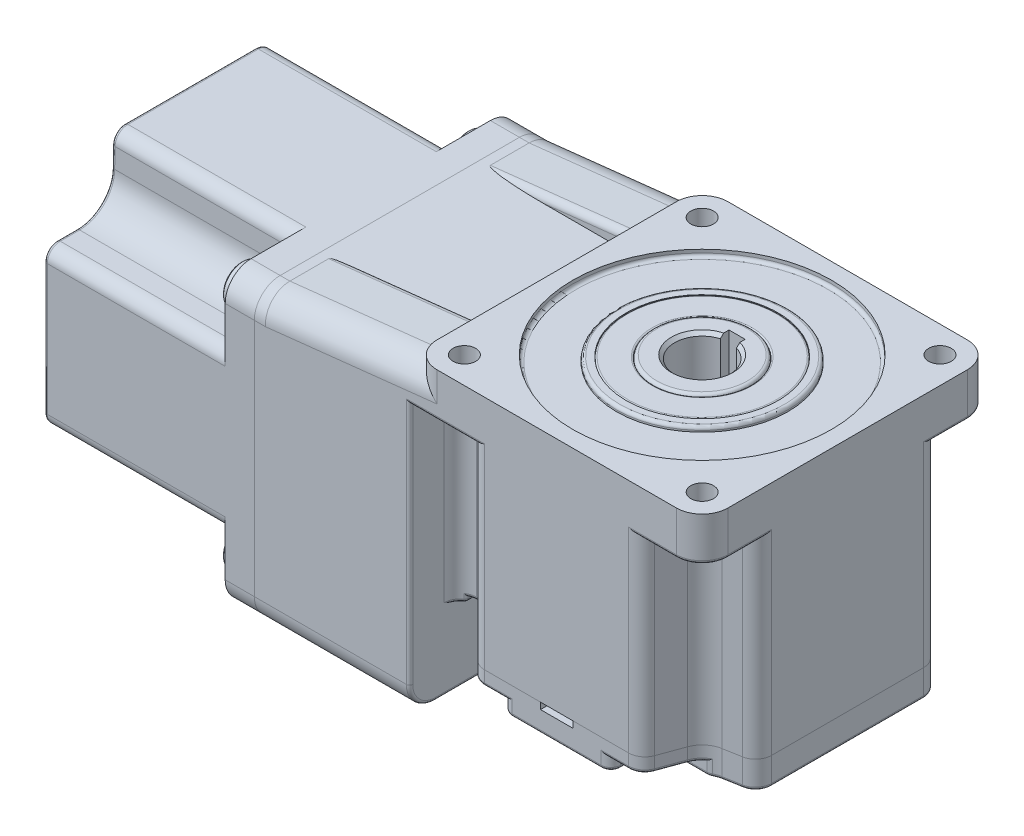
SolidWorks part; units mm, degrees
ref_plane "前视基准面" through (0, 0, 0) normal (0, 0, 1) x (1, 0, 0)
ref_plane "上视基准面" through (0, 0, 0) normal (0, 1, 0) x (1, 0, 0)
ref_plane "右视基准面" through (0, 0, 0) normal (1, 0, 0) x (0, 0, -1)
imported_body "90中空箱体-1-surface1"
imported_body "30X47X7-1-surface1"
imported_body "出轴后盖-1-surface1"
imported_body "30X47X7-2-surface1"
imported_body "空心输出轴-1-surface1"
sketch "草图1" plane through (-75.3062, 0, 0) normal (-1, 0, 0) x (0, 0, 1)
  line L0 (37, 32.9085) -> (-37, 32.9085) construction
  line L2 (-37, -57.0915) -> (37, -57.0915)
  line L3 (-45, -49.0915) -> (-45, 24.9085)
  line L4 (-37, 32.9085) -> (37, 32.9085)
  line L5 (45, -49.0915) -> (45, 24.9085)
  line L6 (-45, -57.0915) -> (45, 32.9085) construction
  line L7 (-45, 32.9085) -> (45, -57.0915) construction
  arc A0 (37, -57.0915) -> (45, -49.0915) centre (37, -49.0915) ccw
  arc A1 (-37, -57.0915) -> (-45, -49.0915) centre (-37, -49.0915) cw
  arc A2 (37, 32.9085) -> (45, 24.9085) centre (37, 24.9085) cw
  arc A3 (-45, 24.9085) -> (-37, 32.9085) centre (-37, 24.9085) cw
  dimension "D1" = 8
extrude "凸台-拉伸1" add sketch "草图1" along normal blind 65
sketch "草图2" plane through (-140.3062, 0, 0) normal (-1, 0, 0) x (0, 0, 1)
  line L0 (-35, 12.0801) -> (-41, 12.0801)
  line L1 (-45, 8.0801) -> (-45, 24.9085)
  line L2 (-35, -36.2631) -> (-35, -36.0631)
  line L3 (-24.1716, -47.0915) -> (-24.1716, -53.0915)
  line L6 (-37, 32.9085) -> (-20.2852, 32.9085)
  line L7 (-45, 24.9085) -> (-45, -49.0915) construction
  line L8 (-35, -36.0631) -> (-41, -36.0631)
  line L10 (20.068, 32.9085) -> (37, 32.9085)
  line L11 (-37, -57.0915) -> (37, -57.0915) construction
  line L13 (24.1716, -47.0915) -> (24.1716, -53.0915)
  line L14 (45, 24.9085) -> (45, 8.0801)
  line L15 (35, -36.2631) -> (41, -36.2631)
  line L16 (45, -49.0915) -> (45, 24.9085) construction
  line L18 (41, 12.0801) -> (35, 12.0801)
  line L19 (45, 8.0801) -> (45.2886, 7.8824)
  line L20 (24.1716, 22.9085) -> (24.0675, 28.9771)
  line L21 (25, 32.9085) -> (23, 32.9085) construction
  line L23 (37, 32.9085) -> (-37, 32.9085) construction
  line L24 (-24.2845, 28.8323) -> (-24.1716, 22.9085)
  line L25 (45, -32.2631) -> (45, -49.0915)
  line L27 (37, -57.0915) -> (20.1716, -57.0915)
  line L28 (-20.1716, -57.0915) -> (-37, -57.0915)
  line L30 (-45, -49.0915) -> (-45, -32.0631)
  arc A0 (-35, 12.0801) -> (-24.1794, 23.3211) centre (-35, 22.9085) ccw
  arc A1 (24.1716, 22.9085) -> (35, 12.0801) centre (35, 22.9085) ccw
  arc A2 (35, -36.2631) -> (24.1716, -47.0915) centre (35, -47.0915) ccw
  arc A3 (-24.1716, -47.0915) -> (-35, -36.2631) centre (-35, -47.0915) ccw
  arc A4 (-37, 32.9085) -> (-45, 24.9085) centre (-37, 24.9085) ccw
  arc A5 (45, 24.9085) -> (37, 32.9085) centre (37, 24.9085) ccw
  arc A6 (37, -57.0915) -> (45, -49.0915) centre (37, -49.0915) ccw
  arc A7 (-45, -49.0915) -> (-37, -57.0915) centre (-37, -49.0915) ccw
  arc A8 (-20.2852, 32.9085) -> (-24.2845, 28.8323) centre (-20.2852, 28.9085) ccw
  arc A9 (24.0675, 28.9771) -> (20.068, 32.9085) centre (20.068, 28.9085) ccw
  arc A10 (45, 8.0801) -> (41, 12.0801) centre (41, 8.0801) ccw
  arc A11 (41, -36.2631) -> (45, -32.2631) centre (41, -32.2631) ccw
  arc A12 (24.1716, -53.0915) -> (20.1716, -57.0915) centre (20.1716, -53.0915) cw
  arc A13 (-24.1716, -53.0915) -> (-20.1716, -57.0915) centre (-20.1716, -53.0915) ccw
  arc A14 (-41, -36.0631) -> (-45, -32.0631) centre (-41, -32.0631) cw
  arc A15 (-41, 12.0801) -> (-45, 8.0801) centre (-41, 8.0801) ccw
  point P0 (0, -12.0915)
  point P47 (-24.3621, 32.9085)
  point P50 (24, 32.9085)
  point P53 (45, 12.0801)
  point P56 (45, -36.2631)
  point P59 (24.1716, -57.0915)
  point P62 (-24.1716, -57.0915)
  point P65 (-45, -36.0631)
  point P68 (-45, 12.0801)
  dimension "D1" = 4
extrude "切除-拉伸1" cut sketch "草图2" against normal blind 56 contours A15 L0 A0 L24 A8 M4 M5 M6 | A10 A9 L20 A1 L18 M2 M3 M4 | L13 A12 A11 L15 A2 M8 M1 M2 | L8 A14 A13 L3 A3 L2 M6 M7 M8
fillet "圆角1" radius 1 25 edges at (-140.3062, -39.4347, -27.3431) (-140.3062, -36.1631, -35) (-140.3062, -36.0631, -38) (-140.3062, -34.8915, -43.8284) (-140.3062, -11.9915, -45) (-140.3062, 10.9085, -43.8284) (-140.3062, 12.0801, -38) (-140.3062, 15.2516, -27.3431) (-140.3062, 25.8704, -24.228) (-140.3062, 31.7098, -23.1404) (-140.3062, 32.9085, -0.1086) (-140.3062, 31.7611, 22.8721) (-140.3062, 25.9428, 24.1195) (-140.3062, 15.2516, 27.3431) (-140.3062, 12.0801, 38) (-140.3062, 10.9085, 43.8284) (-140.3062, -12.0915, 45) (-140.3062, -35.0915, 43.8284) (-140.3062, -36.2631, 38) (-140.3062, -39.4347, 27.3431) (-140.3062, -50.0915, 24.1716) (-140.3062, -55.9199, 23) (-140.3062, -57.0915, 0) (-140.3062, -55.9199, -23) (-140.3062, -50.0915, -24.1716)
sketch "草图3" plane through (-84.3062, 0, 0) normal (-1, 0, 0) x (0, 0, 1)
  circle A0 centre (-35, 22.9085) radius 6
  circle A1 centre (35, 22.9085) radius 6
  circle A2 centre (35, -47.0915) radius 6
  circle A3 centre (-35, -47.0915) radius 6
extrude "凸台-拉伸2" add sketch "草图3" along normal blind 5
sketch "草图4" plane through (-89.3062, 0, 0) normal (-1, 0, 0) x (0, 0, 1)
  line L1 (-33.2679, 25.9085) -> (-36.7321, 25.9085)
  line L2 (-36.7321, 25.9085) -> (-38.4641, 22.9085)
  line L3 (-38.4641, 22.9085) -> (-36.7321, 19.9085)
  line L4 (-36.7321, 19.9085) -> (-33.2679, 19.9085)
  line L5 (-33.2679, 19.9085) -> (-31.5359, 22.9085)
  line L6 (-31.5359, 22.9085) -> (-33.2679, 25.9085)
  line L7 (38.4641, 22.9085) -> (36.7321, 25.9085)
  line L8 (36.7321, 25.9085) -> (33.2679, 25.9085)
  line L9 (33.2679, 25.9085) -> (31.5359, 22.9085)
  line L10 (31.5359, 22.9085) -> (33.2679, 19.9085)
  line L11 (33.2679, 19.9085) -> (36.7321, 19.9085)
  line L12 (36.7321, 19.9085) -> (38.4641, 22.9085)
  line L13 (38.4641, -47.0915) -> (36.7321, -44.0915)
  line L14 (36.7321, -44.0915) -> (33.2679, -44.0915)
  line L15 (33.2679, -44.0915) -> (31.5359, -47.0915)
  line L16 (31.5359, -47.0915) -> (33.2679, -50.0915)
  line L17 (33.2679, -50.0915) -> (36.7321, -50.0915)
  line L18 (36.7321, -50.0915) -> (38.4641, -47.0915)
  line L19 (-31.5359, -47.0915) -> (-33.2679, -44.0915)
  line L20 (-33.2679, -44.0915) -> (-36.7321, -44.0915)
  line L21 (-36.7321, -44.0915) -> (-38.4641, -47.0915)
  line L22 (-38.4641, -47.0915) -> (-36.7321, -50.0915)
  line L23 (-36.7321, -50.0915) -> (-33.2679, -50.0915)
  line L24 (-33.2679, -50.0915) -> (-31.5359, -47.0915)
  circle A0 centre (-35, 22.9085) radius 3 construction
  circle A1 centre (35, 22.9085) radius 3 construction
  circle A2 centre (35, -47.0915) radius 3 construction
  circle A3 centre (-35, -47.0915) radius 3 construction
extrude "切除-拉伸2" cut sketch "草图4" against normal blind 2
chamfer "倒角1" distance 0.5 angle 45 28 edges at (-89.3062, -47.0915, 41) (-89.3062, -45.5915, 37.5981) (-89.3062, -44.0915, 35) (-89.3062, -45.5915, 32.4019) (-89.3062, -48.5915, 32.4019) (-89.3062, -50.0915, 35) (-89.3062, -48.5915, 37.5981) (-89.3062, -47.0915, -29) (-89.3062, -45.5915, -32.4019) (-89.3062, -44.0915, -35) (-89.3062, -45.5915, -37.5981) (-89.3062, -48.5915, -37.5981) (-89.3062, -50.0915, -35) (-89.3062, -48.5915, -32.4019) (-89.3062, 22.9085, 41) (-89.3062, 24.4085, 37.5981) (-89.3062, 25.9085, 35) (-89.3062, 24.4085, 32.4019) (-89.3062, 21.4085, 32.4019) (-89.3062, 19.9085, 35) (-89.3062, 21.4085, 37.5981) (-89.3062, 22.9085, -29) (-89.3062, 25.9085, -35) (-89.3062, 24.4085, -37.5981) (-89.3062, 21.4085, -37.5981) (-89.3062, 19.9085, -35) (-89.3062, 21.4085, -32.4019) (-89.3062, 24.4085, -32.4019)
